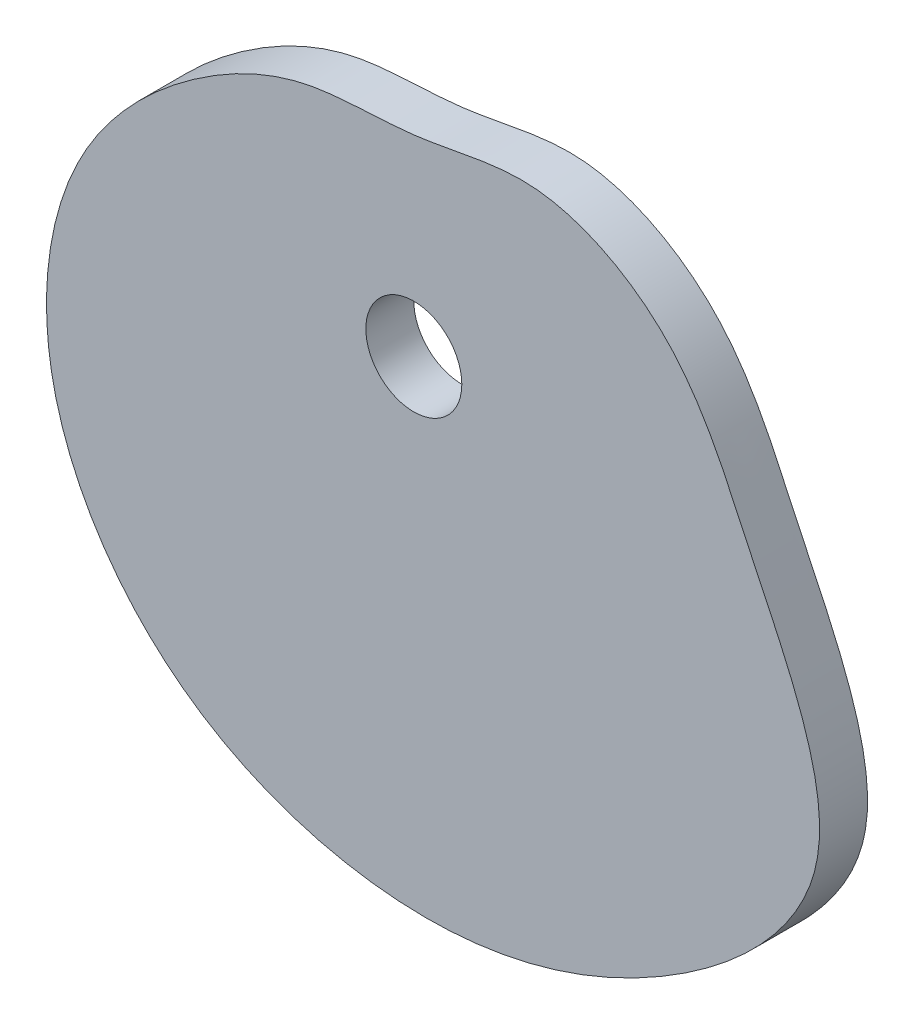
SolidWorks part; units mm, degrees
ref_plane "Front" through (0, 0, 0) normal (0, 0, 1) x (1, 0, 0)
ref_plane "Top" through (0, 0, 0) normal (0, 1, 0) x (1, 0, 0)
ref_plane "Right" through (0, 0, 0) normal (1, 0, 0) x (0, 0, -1)
sketch "Sketch1" plane through (0, 0, 0) normal (0, 0, 1) x (1, 0, 0)
  circle A0 centre (0, 0) radius 10
  point P0 (0, 40)
  point P1 (0, 40)
  point P3 (25, 43)
  point P4 (52, 30)
  point P5 (70, 0)
  point P6 (84, -49)
  point P7 (50, -87)
  point P8 (0, -100)
  point P9 (-48, -84)
  point P10 (-75, -43)
  point P11 (-70, 0)
  point P12 (-46, 27)
  point P13 (-22, 38)
  point P14 (25, 43)
  point P17 (52, 30)
  point P19 (70, 0)
  point P21 (84, -49)
  point P23 (50, -87)
  point P25 (0, -100)
  point P27 (-48, -84)
  point P29 (-75, -43)
  point P31 (-70, 0)
  point P33 (-46, 27)
  point P35 (-22, 38)
extrude "Extrude1" add sketch "Sketch1" along normal blind 10
